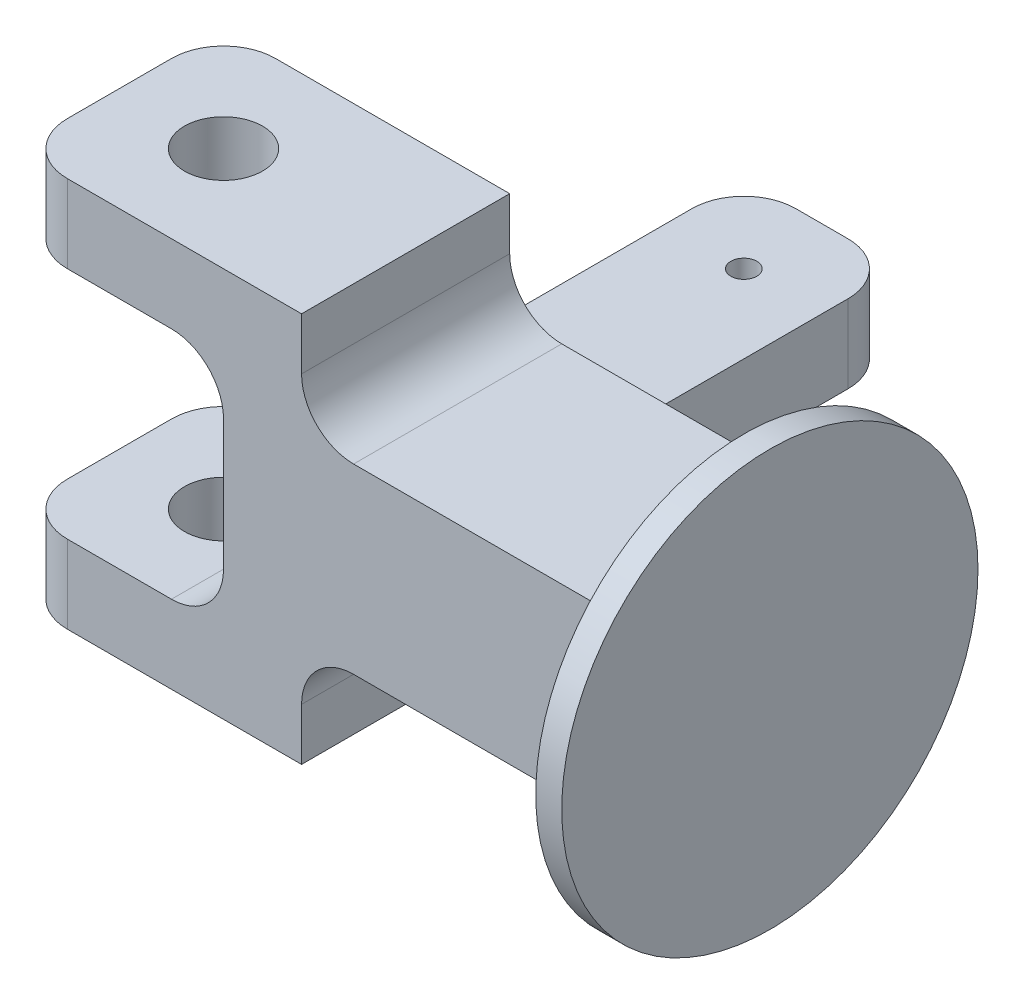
SolidWorks part; units mm, degrees
ref_plane "Front Plane" through (0, 0, 0) normal (0, 0, 1) x (1, 0, 0)
ref_plane "Top Plane" through (0, 0, 0) normal (0, 1, 0) x (1, 0, 0)
ref_plane "Right Plane" through (0, 0, 0) normal (1, 0, 0) x (0, 0, -1)
sketch "Sketch1" plane through (0, 0, 0) normal (0, 1, 0) x (1, 0, 0)
  line L0 (-63.5, -25.4) -> (76.2, -25.4)
  line L1 (-6.35, 95.25) -> (6.35, 95.25)
  line L2 (-19.05, 82.55) -> (-19.05, 25.4)
  line L4 (19.05, 82.55) -> (19.05, 25.4)
  line L5 (19.05, 25.4) -> (76.2, 25.4)
  line L8 (76.2, 25.4) -> (76.2, -25.4)
  line L10 (-19.05, 25.4) -> (-63.5, 25.4)
  line L11 (-76.2, -12.7) -> (-76.2, 12.7)
  circle A0 centre (0, 76.2) radius 3.175
  circle A1 centre (-50.8, 0) radius 9.525
  arc A2 (-19.05, 82.55) -> (-6.35, 95.25) centre (-6.35, 82.55) cw
  arc A3 (6.35, 95.25) -> (19.05, 82.55) centre (6.35, 82.55) cw
  arc A4 (-63.5, -25.4) -> (-76.2, -12.7) centre (-63.5, -12.7) cw
  arc A5 (-76.2, 12.7) -> (-63.5, 25.4) centre (-63.5, 12.7) cw
  dimension "D1" = 6.35
  dimension "D9" = 19.05
  dimension "D12" = 12.7
  dimension "D2" = 76.2
  dimension "D3" = 19.05
  dimension "D4" = 19.05
  dimension "D5" = 19.05
  dimension "D6" = 76.2
  dimension "D7" = 25.4
  dimension "D8" = 25.4
  dimension "D10" = 50.8
  dimension "D11" = 25.4
extrude "Boss-Extrude1" add sketch "Sketch1" along normal mid plane 95.25
sketch "Sketch2" plane through (0, 0, 25.4) normal (0, 0, 1) x (1, 0, 0)
  line L0 (-76.2, 47.625) -> (-76.2, -47.625) construction
  line L1 (-76.2, 28.575) -> (-38.1, 28.575)
  line L2 (-76.2, 28.575) -> (-76.2, -28.575)
  line L3 (-76.2, -28.575) -> (-38.1, -28.575)
  line L4 (-25.4, 15.875) -> (-25.4, -15.875)
  arc A0 (-38.1, -28.575) -> (-25.4, -15.875) centre (-38.1, -15.875) ccw
  arc A1 (-38.1, 28.575) -> (-25.4, 15.875) centre (-38.1, 15.875) cw
  point P9 (-25.4, -28.575)
  point P12 (-25.4, 28.575)
  dimension "D4" = 12.7
  dimension "D1" = 50.8
  dimension "D2" = 57.15
  dimension "D3" = 28.575
extrude "Cut-Extrude1" cut sketch "Sketch2" against normal through all
sketch "Sketch5" plane through (-19.05, 0, 0) normal (-1, 0, 0) x (0, 0, 1)
  line L0 (-25.4, 47.625) -> (-25.4, -47.625) construction
  line L1 (-95.25, 47.625) -> (-25.4, 47.625)
  line L2 (-95.25, 47.625) -> (-95.25, 9.525)
  line L3 (-95.25, 9.525) -> (-38.1, 9.525)
  line L4 (-25.4, 47.625) -> (-25.4, 22.225)
  line L5 (-25.4, -15.875) -> (-25.4, 15.875) construction
  line L6 (-38.1, -9.525) -> (-95.25, -9.525)
  line L7 (-25.4, -22.225) -> (-25.4, -47.625)
  line L8 (-25.4, -47.625) -> (-95.25, -47.625)
  line L9 (-95.25, -9.525) -> (-95.25, -47.625)
  arc A0 (-38.1, -9.525) -> (-25.4, -22.225) centre (-38.1, -22.225) cw
  arc A1 (-38.1, 9.525) -> (-25.4, 22.225) centre (-38.1, 22.225) ccw
  point P16 (-25.4, -9.525)
  point P19 (-25.4, 9.525)
  dimension "D3" = 12.7
  dimension "D1" = 19.05
extrude "Cut-Extrude2" cut sketch "Sketch5" against normal through all
sketch "Sketch6" plane through (0, 0, -25.4) normal (0, 0, -1) x (-1, 0, 0)
  line L0 (-76.2, 22.225) -> (-6.35, 22.225)
  line L1 (-76.2, 47.625) -> (-76.2, -47.625) construction
  line L2 (-19.05, 22.225) -> (19.05, 22.225) construction
  line L3 (6.35, 34.925) -> (6.35, 47.625)
  line L4 (-76.2, 47.625) -> (63.5, 47.625) construction
  line L5 (25.4, -15.875) -> (25.4, 15.875) construction
  line L6 (-76.2, 22.225) -> (-76.2, 47.625)
  line L7 (-76.2, 47.625) -> (6.35, 47.625)
  arc A0 (-6.35, 22.225) -> (6.35, 34.925) centre (-6.35, 34.925) ccw
  point P14 (6.35, 22.225)
  dimension "D2" = 12.7
  dimension "D1" = 19.05
extrude "Cut-Extrude3" cut sketch "Sketch6" against normal through all
mirror "Mirror1" about plane through (0, 0, 0) normal (0, 1, 0) of "Cut-Extrude3"
sketch "Sketch7" plane through (76.2, 0, 0) normal (1, 0, 0) x (0, 0, -1)
  circle A0 centre (0, 0) radius 50.8
  dimension "D1" = 101.6
extrude "Boss-Extrude2" add sketch "Sketch7" along normal blind 6.35
sketch "Sketch8" plane through (0, 0, 0) normal (0, 1, 0) x (1, 0, 0)
  line L0 (0, 0) -> (244.6914, 0) construction
  line L1 (0, 0) -> (-145.0703, 0) construction
ref_plane "Plane1" through (0, 0, -76.2) normal (0, 0, -1) x (-1, 0, 0)
sketch "Sketch9" plane through (0, 0, -76.2) normal (0, 0, -1) x (-1, 0, 0)
  line L0 (0, 26.4972) -> (0, -27.3538) construction
  line L1 (0, 9.525) -> (0, -9.525) construction
  line L2 (-6.35, 9.525) -> (6.35, 9.525) construction
  line L4 (-6.35, -9.525) -> (6.35, -9.525) construction
  point P5 (0, 17.0561)
  point P6 (0, -17.0561)
  dimension "D1" = 7.5311
  dimension "D2" = 7.5311
sketch "Sketch10" plane through (0, 0, 0) normal (0, 0, 1) x (1, 0, 0)
  line L0 (-50.8, -73.025) -> (-50.8, 73.025) construction
  line L1 (-50.8, 47.625) -> (-50.8, 28.575) construction
  line L2 (0, 0) -> (-145.0703, 0) construction
  point P5 (-50.8, 73.025)
  point P6 (-50.8, -73.025)
  dimension "D1" = 146.05
  dimension "D2" = 73.025
ref_plane "Plane2" through (0, -17.0561, -76.2) normal (0, -1, 0) x (-1, 0, 0)
sketch "Sketch11" plane through (0, -17.0561, -76.2) normal (0, -1, 0) x (-1, 0, 0)
  line L0 (50.8, -76.2) -> (50.8, 125.0465) construction
  line L1 (50.8, -76.2) -> (5.8205, 99.2376) construction
  point P3 (22.4134, 34.519)
  dimension "D1" = 14.38
  dimension "D2" = 114.3
